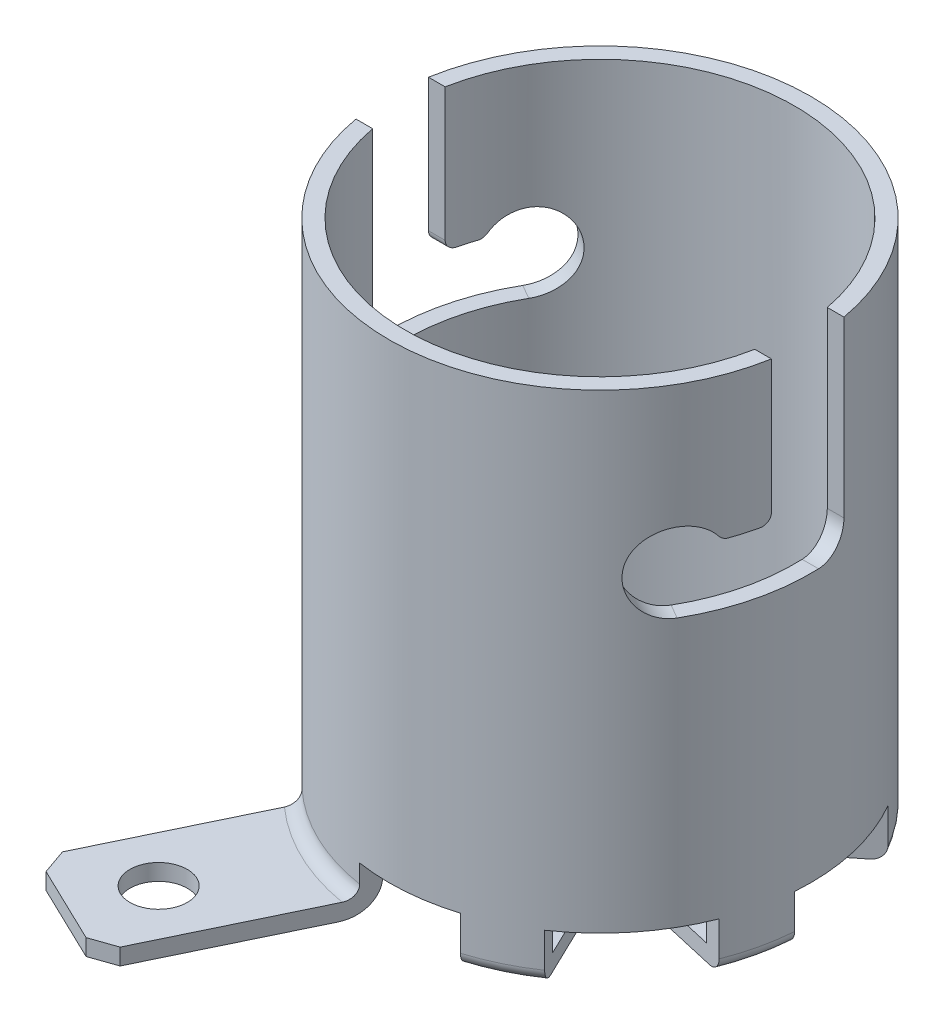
SolidWorks part; units mm, degrees
ref_plane "Front Plane" through (0, 0, 0) normal (0, 0, 1) x (1, 0, 0)
ref_plane "Top Plane" through (0, 0, 0) normal (0, 1, 0) x (1, 0, 0)
ref_plane "Right Plane" through (0, 0, 0) normal (1, 0, 0) x (0, 0, -1)
sketch "Sketch1" plane through (0, 0, 0) normal (0, 1, 0) x (1, 0, 0)
  circle A0 centre (0, 0) radius 8.4963
  dimension "D1" = 16.9926
extrude "Boss-Extrude1" add sketch "Sketch1" against normal blind 20.8534
fillet "Fillet1" radius 0.508 1 edges at (0, -20.8534, 8.4963)
shell "Shell1" thickness 0.6604
sketch "Sketch2" plane through (0, -20.8534, 0) normal (0, -1, 0) x (1, 0, 0)
  circle A0 centre (0, 0) radius 2.3813
  dimension "D1" = 4.7625
extrude "Cut-Extrude1" cut sketch "Sketch2" against normal blind 2.54
sketch "Sketch3" plane through (0, -20.8534, 0) normal (0, -1, 0) x (1, 0, 0)
  line L0 (0, 0) -> (0, -12.0557) construction
  line L1 (1.27, -12.0557) -> (1.27, 0) construction
  line L2 (-1.27, -12.0557) -> (-1.27, -0.8493) construction
  line L3 (-10.2174, -6.5237) -> (-1.4559, 0.4634) construction
  line L4 (-8.6337, -8.5095) -> (0.7918, -0.9929) construction
  line L5 (-11.4708, 3.9208) -> (-0.5454, 1.4272) construction
  line L6 (-12.0361, 1.4445) -> (-0.2826, -1.2382) construction
  line L7 (-4.0865, 11.4129) -> (0.7757, 1.3163) construction
  line L8 (-6.375, 10.3108) -> (-1.1442, -0.551) construction
  line L9 (6.375, 10.3108) -> (1.5127, 0.2142) construction
  line L10 (4.0865, 11.4129) -> (-1.1442, 0.551) construction
  line L11 (12.0361, 1.4445) -> (1.1106, -1.0492) construction
  line L12 (11.4708, 3.9208) -> (-0.2826, 1.2382) construction
  line L13 (8.6337, -8.5095) -> (-0.1278, -1.5225) construction
  line L14 (10.2174, -6.5237) -> (0.7918, 0.9929) construction
  line L15 (1.27, -2.6372) -> (1.27, -9.1167)
  line L16 (1.27, -2.6372) -> (6.2827, -6.6346)
  line L17 (1.27, -9.1167) -> (6.2827, -6.6346)
  circle A0 centre (0, -12.0557) radius 1.27 construction
  point P35 (0, 0)
  dimension "D1" = 2.54
  dimension "D2" = 7
extrude "Cut-Extrude2" cut sketch "Sketch3" against normal blind 1.905
pattern_circular "CirPattern1" count 7 over 360 about axis through (0, 0, 0) along (0, 1, 0) of "Cut-Extrude2"
sketch "Sketch4" plane through (0, 0, 0) normal (1, 0, 0) x (0, 0, -1)
  line L0 (0, 0) -> (0, -6.7871) construction
  line L1 (8.4963, 0) -> (-8.4963, 0) construction
  line L2 (-1.4605, -8.1534) -> (1.4605, -8.1534)
  line L3 (-1.4605, -8.1534) -> (-1.4605, 0)
  line L4 (-1.4605, 0) -> (1.4605, 0)
  line L5 (1.4605, -8.1534) -> (1.4605, 0)
  line L6 (-1.4605, -8.1534) -> (1.4605, 0) construction
  line L7 (-1.4605, 0) -> (1.4605, -8.1534) construction
  point P3 (0, -4.0767)
  dimension "D1" = 8.1534
  dimension "D2" = 2.921
extrude "Cut-Extrude3" cut sketch "Sketch4" against normal through all
sketch "Sketch5" plane through (0, 0, 0) normal (0, 1, 0) x (1, 0, 0)
  line L0 (0, 0) -> (0, -8.763) construction
  line L1 (0, 0) -> (-8.8512, 0) construction
  line L2 (0, 0) -> (5.6121, 9.7205) construction
  line L3 (0, 0) -> (3.0117, 11.2397) construction
  dimension "D1" = 120
  dimension "D2" = 15
ref_plane "Plane1" through (0, 0, 0) normal (-0.866, 0, -0.5) x (-0.5, 0, 0.866)
sketch "Sketch6" plane through (0, 0, 0) normal (-0.866, 0, -0.5) x (-0.5, 0, 0.866)
  line L0 (0, 0) -> (0, -9.1386) construction
  line L1 (0, -8.1534) -> (0, 0) construction
  line L2 (2.9201, -8.1534) -> (-2.98, -8.1534) construction
  line L3 (2.9201, -6.5659) -> (-2.98, -6.5659) construction
  circle A0 centre (0, -6.5659) radius 1.5875
  dimension "D1" = 1.5875
extrude "Cut-Extrude4" cut sketch "Sketch6" along normal through all
ref_plane "Plane2" through (0, 0, 0) normal (0.9659, 0, 0.2588) x (0.2588, 0, -0.9659)
sketch "Sketch8" plane through (0, 0, 0) normal (0.9659, 0, 0.2588) x (0.2588, 0, -0.9659)
  line L0 (-0.7555, -8.1534) -> (-3.577, -8.1534) construction
  line L1 (0.995, -8.1534) -> (-1.545, -8.1534)
  line L2 (0.995, -5.7404) -> (-1.545, -5.7404)
  line L3 (0.8382, -8.1534) -> (-2.2098, -8.1534) construction
  line L4 (0.8382, -5.7404) -> (-2.2098, -5.7404) construction
  line L5 (0.995, -5.7404) -> (0.995, -8.1534)
  line L6 (-1.545, -5.7404) -> (-1.545, -8.1534)
  dimension "D1" = 2.54
  dimension "D3" = 2.032
  dimension "D2" = 2.413
extrude "Cut-Extrude5" cut sketch "Sketch8" against normal through all
sketch "Sketch9" plane through (0, 0, 0) normal (-0.866, 0, -0.5) x (-0.5, 0, 0.866)
  line L0 (0, -6.5659) -> (0, -8.1534)
  line L1 (0, -8.1534) -> (3.175, -8.1534)
  line L2 (5.4497, -8.1534) -> (1.2228, -8.1534) construction
  line L3 (3.175, -8.1534) -> (3.175, -6.5659)
  line L4 (3.175, -6.5659) -> (0, -6.5659)
  circle A0 centre (0, -6.5659) radius 1.5875 construction
  dimension "D1" = 3.175
extrude "Cut-Extrude6" cut sketch "Sketch9" along normal through all
fillet "Fillet2" radius 1.143 1 edges at (-8.0342, -8.1534, 1.4605)
fillet "Fillet3" radius 0.381 2 edges at (-8.0342, -5.7404, -1.4605) (-7.6517, -5.7404, -2.8519)
pattern_circular "CirPattern2" count 2 over 360 about axis through (0, -20.8534, 0) along (0, 1, 0) of "Fillet3", "Fillet2", "Cut-Extrude5", "Cut-Extrude4", "Cut-Extrude3", "Cut-Extrude6"
sketch "Sketch10" plane through (0, -20.8534, 0) normal (0, -1, 0) x (1, 0, 0)
  line L0 (0, 0) -> (1.27, -2.6372)
  line L1 (1.27, -2.6372) -> (1.3991, -2.9053)
extrude "Cut-Extrude-Thin4" cut sketch "Sketch10" against normal through all thin
pattern_circular "CirPattern3" count 7 over 360 about axis through (0, -20.8534, 0) along (0, 1, 0) of "Cut-Extrude-Thin4"
sketch "Sketch11" plane through (0, -20.8534, 0) normal (0, -1, 0) x (1, 0, 0)
  line L0 (-5.4233, 8.3346) -> (-3.1349, 9.4367)
  line L4 (-4.5661, 6.5546) -> (-2.3139, 1.8777)
  line L5 (-2.3139, 1.8777) -> (-1.8458, 1.5045)
  line L6 (-0.0254, 2.3811) -> (-0.0254, 2.9798)
  line L7 (-0.0254, 2.9798) -> (-2.2777, 7.6567)
  line L8 (-5.4233, 8.3346) -> (-2.3139, 1.8777)
  line L9 (-2.3139, 1.8777) -> (-1.8458, 1.5045)
  line L10 (-0.0254, 2.3811) -> (-0.0254, 2.9798)
  line L11 (-0.0254, 2.9798) -> (-3.1349, 9.4367)
  arc A2 (-0.0254, 2.3811) -> (-1.8458, 1.5045) centre (0, 0) ccw
  arc A3 (-2.2777, 7.6567) -> (-4.5661, 6.5546) centre (0, 0) ccw
  arc A4 (-0.0254, 2.3811) -> (-1.8458, 1.5045) centre (0, 0) ccw
  dimension "D1" = 0
extrude "Cut-Extrude7" cut sketch "Sketch11" against normal blind 0.762
sketch "Sketch12" plane through (0, -20.0914, 0) normal (0, -1, 0) x (1, 0, 0)
  line L2 (-4.7892, 7.0179) -> (-4.4991, 6.4155)
  line L3 (-2.2107, 7.5176) -> (-2.5008, 8.1199)
  line L4 (-4.7892, 7.0179) -> (-4.4991, 6.4155)
  line L5 (-2.2107, 7.5176) -> (-2.5008, 8.1199)
  arc A2 (-2.2107, 7.5176) -> (-4.4991, 6.4155) centre (0, 0) ccw
  arc A3 (-2.5008, 8.1199) -> (-4.7892, 7.0179) centre (0, 0) ccw
  arc A4 (-2.2107, 7.5176) -> (-4.4991, 6.4155) centre (0, 0) ccw
  arc A5 (-2.5008, 8.1199) -> (-4.7892, 7.0179) centre (0, 0) ccw
  dimension "D1" = 0
extrude "Boss-Extrude2" add sketch "Sketch12" along normal up to surface (0.762 mm away)
sketch "Sketch13" plane through (0, -20.8534, 0) normal (0, -1, 0) x (1, 0, 0)
  line L0 (-3.3999, 7.0599) -> (-6.4517, 13.397) construction
  line L1 (0, 0) -> (-3.3999, 7.0599) construction
  line L2 (-9.2353, 13.4403) -> (-5.3781, 5.4306)
  line L3 (-9.2353, 13.4403) -> (-4.7499, 15.6003)
  line L4 (-5.3781, 5.4306) -> (-0.8927, 7.5907)
  line L5 (-4.7499, 15.6003) -> (-0.8927, 7.5907)
  line L6 (-9.2353, 13.4403) -> (-0.8927, 7.5907) construction
  line L7 (-5.3781, 5.4306) -> (-4.7499, 15.6003) construction
  arc A0 (-2.2107, 7.5176) -> (-4.4991, 6.4155) centre (0, 0) ccw construction
  arc A1 (-2.5008, 8.1199) -> (-4.7892, 7.0179) centre (0, 0) ccw construction
  point P8 (-5.064, 10.5155)
  point P15 (-3.6864, 7.6549)
  dimension "D1" = 4.9784
  dimension "D2" = 7.62
  dimension "D3" = 8.89
extrude "Boss-Extrude3" add sketch "Sketch13" against normal blind 0.6604
sketch "Sketch14" plane through (0, -20.8534, 0) normal (0, -1, 0) x (1, 0, 0)
  line L0 (-5.3781, 5.4306) -> (-0.8927, 7.5907) construction
  line L1 (-5.3781, 5.4306) -> (-0.8927, 7.5907)
  line L2 (-9.2353, 13.4403) -> (-5.3781, 5.4306) construction
  line L3 (-0.8927, 7.5907) -> (-4.7499, 15.6003) construction
  line L4 (-5.4665, 5.6142) -> (-5.3781, 5.4306)
  line L5 (-0.8927, 7.5907) -> (-0.9811, 7.7742)
  arc A1 (-0.9811, 7.7742) -> (-5.4665, 5.6142) centre (0, 0) ccw
  arc A2 (2.2107, 7.5176) -> (-2.2107, 7.5176) centre (0, 0) ccw construction
extrude "Cut-Extrude9" cut sketch "Sketch14" against normal through all
sketch "Sketch15" plane through (0, -20.193, 0) normal (0, 1, 0) x (1, 0, 0)
  line L0 (-9.2353, -13.4403) -> (-5.4665, -5.6142) construction
  line L1 (-0.9811, -7.7742) -> (-4.7499, -15.6003) construction
  line L2 (-5.7673, -6.239) -> (-5.4665, -5.6142)
  line L3 (-0.9811, -7.7742) -> (-1.282, -8.399)
  arc A0 (-4.7892, -7.0179) -> (-2.5008, -8.1199) centre (0, 0) ccw construction
  arc A1 (-5.7673, -6.239) -> (-1.282, -8.399) centre (0, 0) ccw
  arc A2 (-5.4665, -5.6142) -> (-4.4991, -6.4155) centre (0, 0) ccw construction
  arc A3 (-5.4665, -5.6142) -> (-0.9811, -7.7742) centre (0, 0) ccw
extrude "Boss-Extrude4" add sketch "Sketch15" along normal blind 3.2004
fillet "Fillet4" radius 0.508 1 edges at (-3.6864, -20.193, 7.6549)
fillet "Fillet5" radius 1.27 1 edges at (-3.3999, -20.8534, 7.0599)
chamfer "Chamfer1" distance 0.762 angle 45 2 edges at (-9.2353, -20.5232, 13.4403) (-4.7499, -20.5232, 15.6003)
sketch "Sketch16" plane through (0, -20.193, 0) normal (0, 1, 0) x (1, 0, 0)
  line L0 (-6.9926, -14.5203) -> (-4.317, -8.9644) construction
  line L1 (-5.4364, -15.2697) -> (-8.5488, -13.7709) construction
  circle A0 centre (-5.7803, -12.003) radius 1.1557
  dimension "D1" = 2.3114
  dimension "D2" = 2.794
extrude "Cut-Extrude10" cut sketch "Sketch16" against normal blind 3.2004
